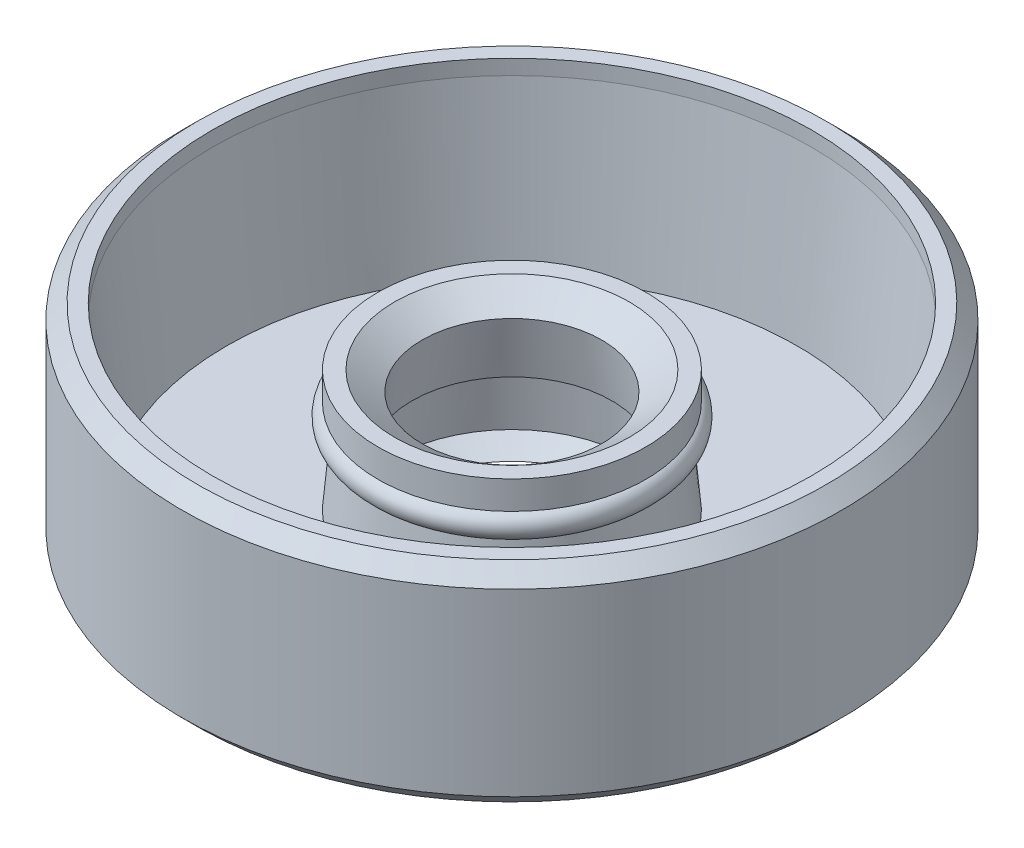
SolidWorks part; units mm, degrees
ref_plane "前视基准面" through (0, 0, 0) normal (0, 0, 1) x (1, 0, 0)
ref_plane "上视基准面" through (0, 0, 0) normal (0, 1, 0) x (1, 0, 0)
ref_plane "右视基准面" through (0, 0, 0) normal (1, 0, 0) x (0, 0, -1)
sketch "草图1" plane through (0, 0, 0) normal (0, 0, 1) x (1, 0, 0)
  line L0 (-10.5, 0) -> (-4.4732, 0)
  line L1 (-9.5188, 1) -> (-4.4732, 1)
  line L2 (-11, 6.5) -> (-11, 0.5)
  line L3 (-10, 6.5) -> (-10, 7)
  line L4 (-10, 6.5) -> (-9.5188, 1)
  line L5 (-11, 0.5) -> (-10.5, 0)
  line L6 (-10.5, 7) -> (-11, 6.5)
  line L7 (-10, 7) -> (-10.5, 7)
  line L8 (-3, 4.4286) -> (-3.9181, 5.0714)
  line L9 (-3.3401, 2.5) -> (-3, 4.4286)
  line L10 (-4.015, 0.5) -> (-3.8401, 2.5)
  line L11 (-4.2732, 3.286) -> (-4.4732, 1)
  line L12 (-4.015, 0) -> (-4.4732, 0.5)
  line L13 (-4.4732, 0.5) -> (-4.4732, 0)
  line L14 (-4.015, 0.5) -> (-3.3401, 0.0591)
  line L15 (-4.015, 0) -> (-3.3401, 0.0591)
  line L16 (-3.9181, 5.0714) -> (-4.4732, 5.0714)
  line L17 (-4.4732, 5.0714) -> (-4.4732, 4.1332)
  line L18 (-3.3401, 2.5) -> (-3.8401, 2.5)
  line L19 (0, 5.9773) -> (0, -9.5227) construction
  line L20 (-10.5, 0) -> (-10.5, 0.5) construction
  line L21 (-4.3673, 2.2109) -> (-3.8692, 2.1674) construction
  line L22 (-9.5188, 1) -> (-9.5188, 0.5) construction
  arc A0 (-4.4732, 4.1332) -> (-4.2732, 3.286) centre (-4.2732, 3.7332) ccw
  dimension "D12" = 0.6429
  dimension "D3" = 45
  dimension "D4" = 45
  dimension "D5" = 0.2
  dimension "D6" = 0.4
  dimension "D7" = 145
  dimension "b" = 7
  dimension "D8" = 85
  dimension "D9" = 95
  dimension "D10" = 2.5
  dimension "D11" = 1.9286
  dimension "D13" = 5
  dimension "D14" = 100
  dimension "d1" = 6
  dimension "dm" = 22
  dimension "r" = 0.5
revolve "旋转1" add sketch "草图1" angle 360 about L19
equation "\"D10@草图1\" = \"b@草图1\" / 2 - 1"
equation "\"D11@草图1\" =  ( \"b@草图1\" - \"D10@草图1\" )  / 7 * 3"
equation "\"D12@草图1\" = \"D11@草图1\" / 3"
equation "\"D6@草图1\" = \"r@草图1\" / 5 * 4"
equation "\"D5@草图1\" = \"D6@草图1\" / 2"
